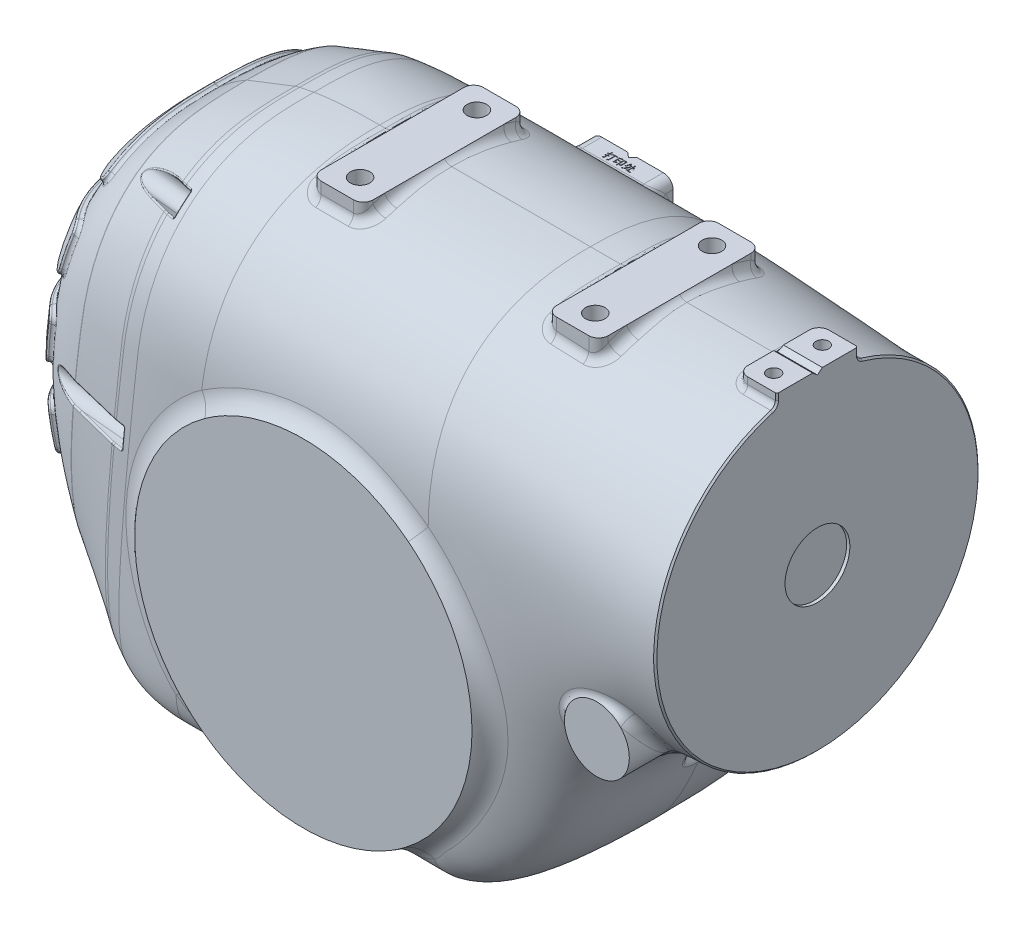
SolidWorks part; units mm, degrees
ref_plane "前视基准面" through (0, 0, 0) normal (0, 0, 1) x (1, 0, 0)
ref_plane "上视基准面" through (0, 0, 0) normal (0, 1, 0) x (1, 0, 0)
ref_plane "右视基准面" through (0, 0, 0) normal (1, 0, 0) x (0, 0, -1)
imported_body "输入1"
sketch "草图1" plane through (0, 0, 0) normal (1, 0, 0) x (0, 0, -1)
  circle A0 centre (0, 0) radius 10
  dimension "D1" = 20
extrude "切除-拉伸1" cut sketch "草图1" against normal blind 1
